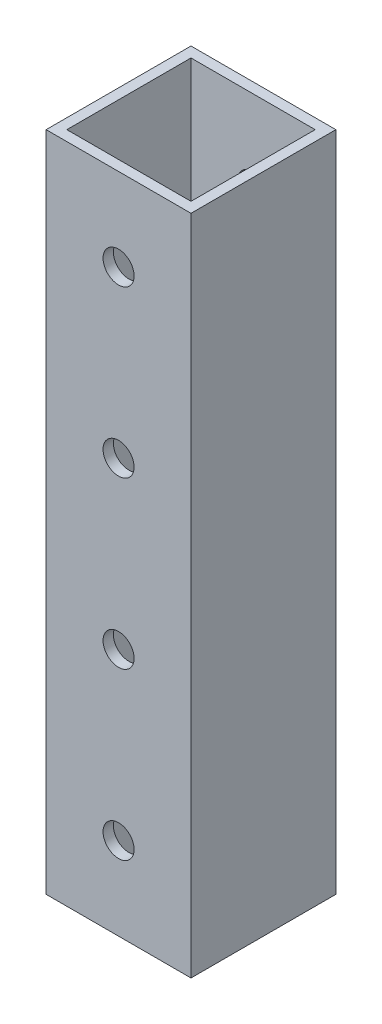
SolidWorks part; units mm, degrees
ref_plane "Front Plane" through (0, 0, 0) normal (0, 0, 1) x (1, 0, 0)
ref_plane "Top Plane" through (0, 0, 0) normal (0, 1, 0) x (1, 0, 0)
ref_plane "Right Plane" through (0, 0, 0) normal (1, 0, 0) x (0, 0, -1)
sketch "Sketch1" plane through (0, 0, 0) normal (0, 1, 0) x (1, 0, 0)
  line L1 (-28.575, 15.875) -> (15.875, 15.875)
  line L2 (-28.575, 15.875) -> (-28.575, -28.575)
  line L3 (-28.575, -28.575) -> (15.875, -28.575)
  line L4 (15.875, 15.875) -> (15.875, -28.575)
  line L5 (-25.4, 12.7) -> (12.7, 12.7)
  line L6 (-25.4, 12.7) -> (-25.4, -25.4)
  line L7 (-25.4, -25.4) -> (12.7, -25.4)
  line L8 (12.7, 12.7) -> (12.7, -25.4)
  dimension "D1" = 15.875
  dimension "D2" = 44.45
  dimension "D3" = 44.45
  dimension "D4" = 15.875
  dimension "D5" = 3.175
  dimension "D6" = 3.175
  dimension "D7" = 3.175
  dimension "D8" = 3.175
extrude "Boss-Extrude1" add sketch "Sketch1" along normal blind 203.2 contours L1 L4 L3 L2 | L6 L7 L8 L5
sketch "Sketch2" plane through (0, 0, -15.875) normal (0, 0, -1) x (-1, 0, 0)
  line L1 (-15.875, 101.6) -> (28.575, 101.6) construction
  line L2 (-15.875, 203.2) -> (-15.875, 0) construction
  line L3 (28.575, 203.2) -> (28.575, 0) construction
  circle A0 centre (6.35, 76.2) radius 4.7625
  circle A1 centre (6.35, 127) radius 4.7625
  circle A2 centre (6.35, 177.8) radius 4.7625
  circle A3 centre (6.35, 25.4) radius 4.7625
  point P4 (28.575, 101.6)
  dimension "D6" = 9.525
  dimension "D7" = 9.525
  dimension "D8" = 9.525
  dimension "D9" = 9.525
  dimension "D1" = 50.8
  dimension "D2" = 0
  dimension "D3" = 25.4
  dimension "D4" = 50.8
  dimension "D5" = 50.8
extrude "Cut-Extrude1" cut sketch "Sketch2" against normal through all
